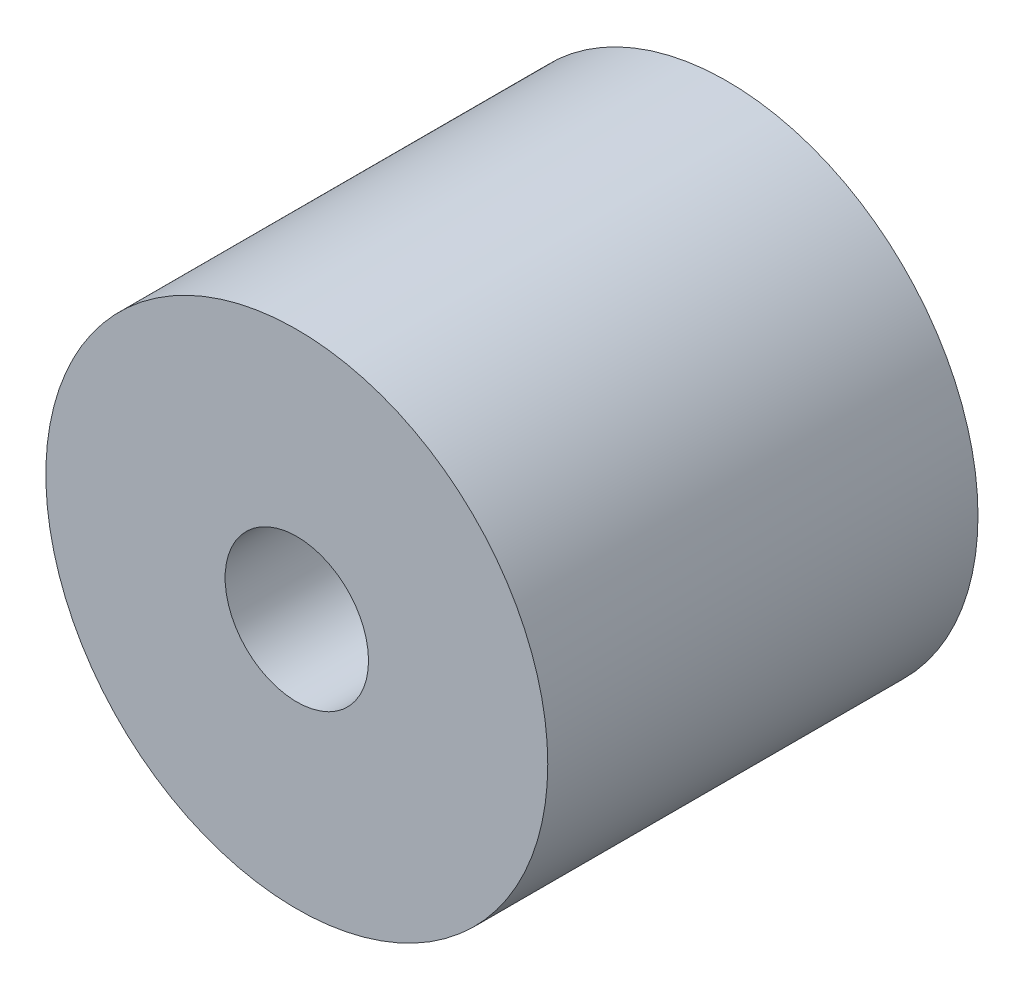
SolidWorks part; units mm, degrees
ref_plane "Plan de face" through (0, 0, 0) normal (0, 0, 1) x (1, 0, 0)
ref_plane "Plan de dessus" through (0, 0, 0) normal (0, 1, 0) x (1, 0, 0)
ref_plane "Plan de droite" through (0, 0, 0) normal (1, 0, 0) x (0, 0, -1)
sketch "Esquisse1" plane through (0, 0, 0) normal (0, 0, 1) x (1, 0, 0)
  circle A0 centre (0, 0) radius 5
  circle A1 centre (0, 0) radius 17.5
  dimension "D1" = 10
  dimension "D2" = 35
extrude "Extrusion1" add sketch "Esquisse1" along normal blind 30
